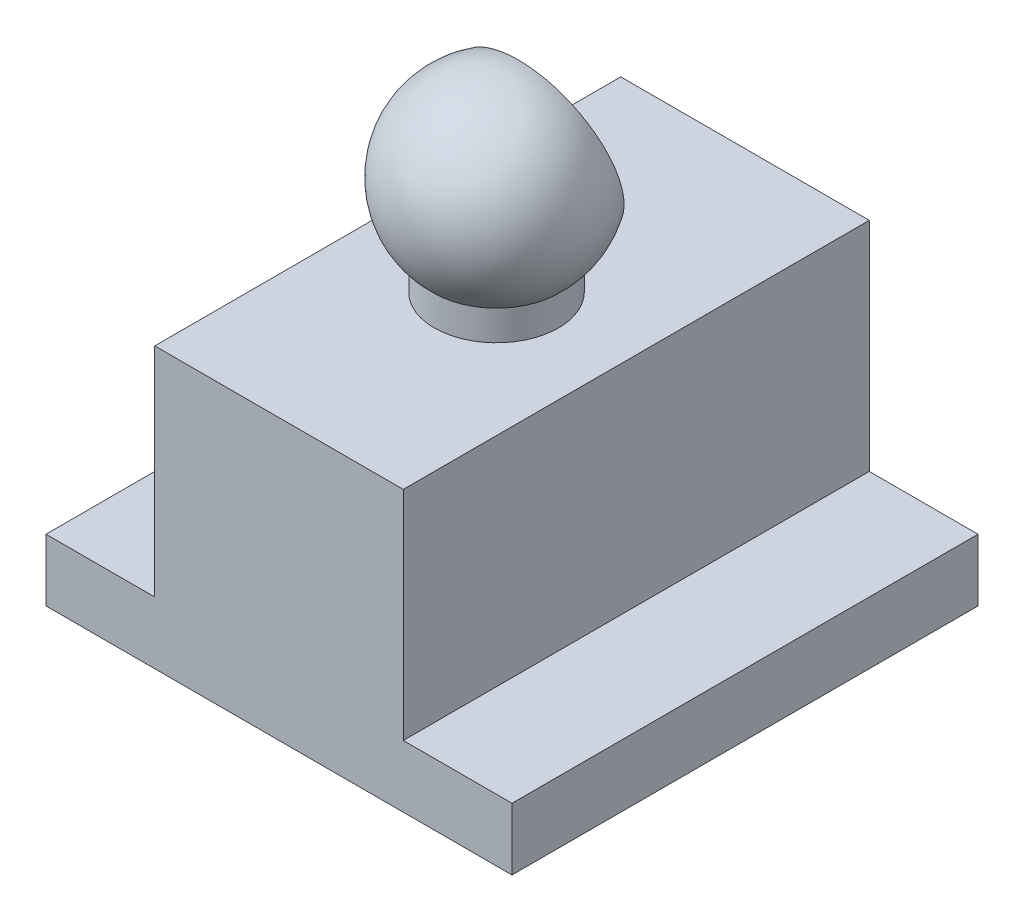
SolidWorks part; units mm, degrees
ref_plane "Front Plane" through (0, 0, 0) normal (0, 0, 1) x (1, 0, 0)
ref_plane "Top Plane" through (0, 0, 0) normal (0, 1, 0) x (1, 0, 0)
ref_plane "Right Plane" through (0, 0, 0) normal (1, 0, 0) x (0, 0, -1)
imported_body "moving part-1-solid1"
imported_body "universal-1-solid1"
combine bodies "Combine1" operation type add bodies to combine 101 102
ref_point "SphCtr_SliderBlock"
